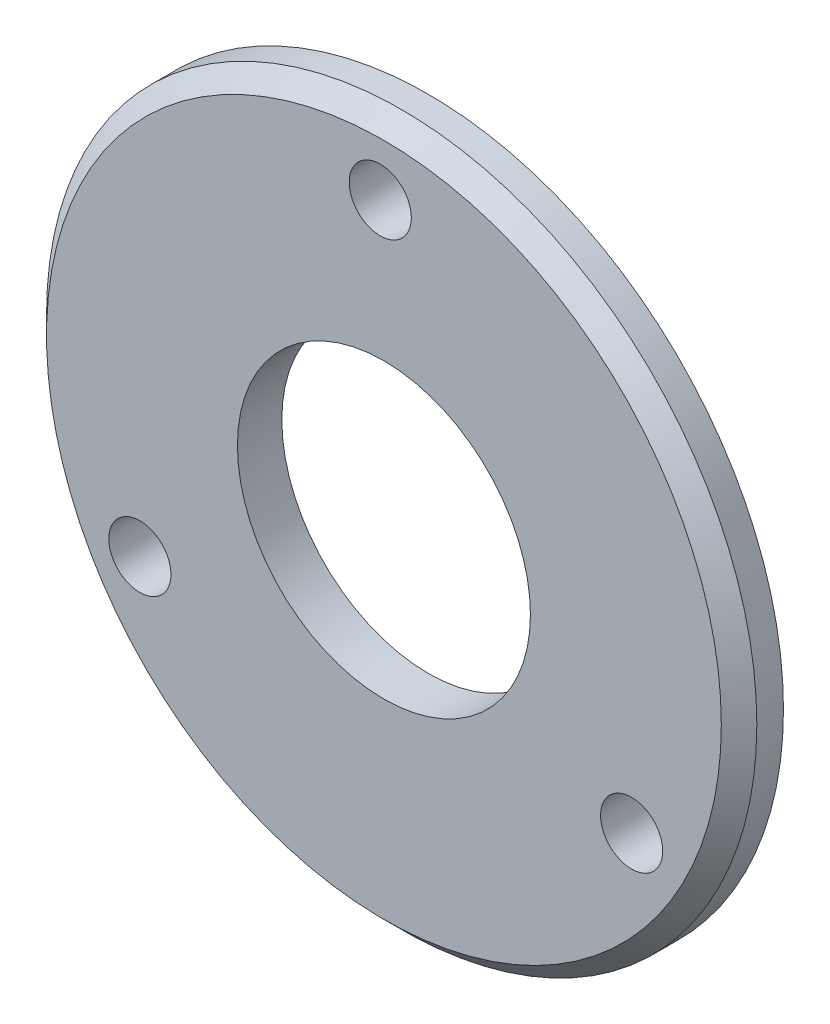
SolidWorks part; units mm, degrees
ref_plane "Plan de face" through (0, 0, 0) normal (0, 0, 1) x (1, 0, 0)
ref_plane "Plan de dessus" through (0, 0, 0) normal (0, 1, 0) x (1, 0, 0)
ref_plane "Plan de droite" through (0, 0, 0) normal (1, 0, 0) x (0, 0, -1)
sketch "Esquisse2" plane through (0, 0, -40.4051) normal (0, 0, 1) x (1, 0, 0)
  circle A0 centre (-300.4114, 242.6874) radius 3.5
  circle A1 centre (-327.4872, 194.3657) radius 3.5
  circle A2 centre (-272.1014, 195.0782) radius 3.5
  circle A3 centre (-300, 210.7104) radius 40
  circle A4 centre (-300, 210.7104) radius 16.5
  dimension "D1" = 33
  dimension "D2" = 7
  dimension "D3" = 7
  dimension "D4" = 7
extrude "Boss.-Extru.1" add sketch "Esquisse2" along normal blind 5
chamfer "Chanfrein1" distance 2 angle 45 1 edges at (-260, 210.7104, -35.4051)
